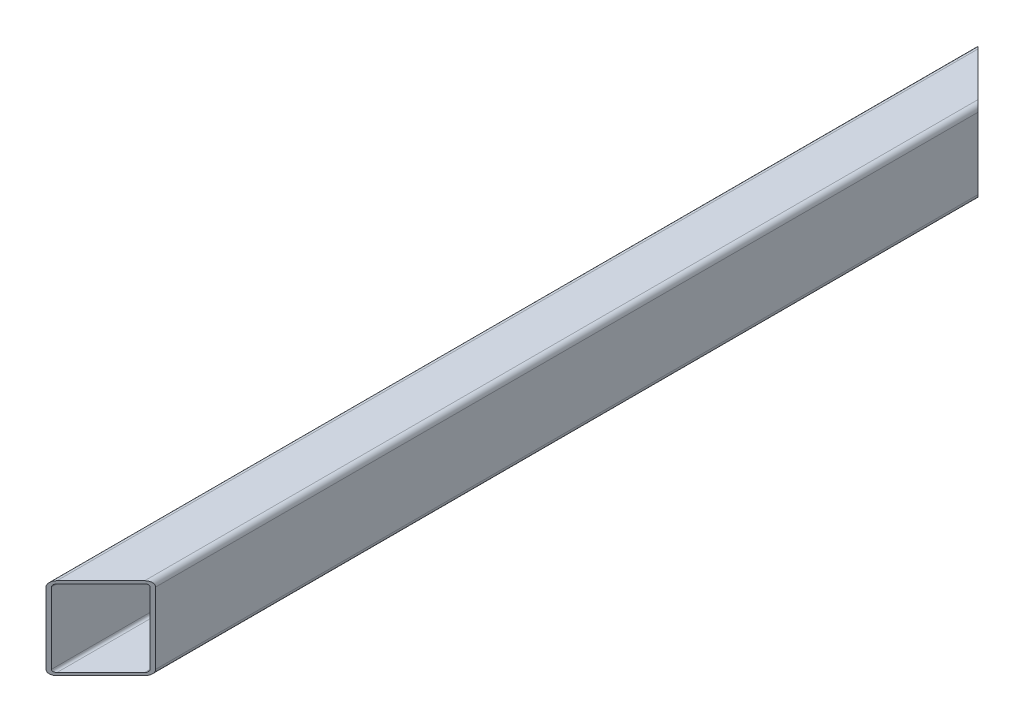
SolidWorks part; units mm, degrees
ref_plane "Plan1" through (0, 0, 0) normal (0, 0, 1) x (1, 0, 0)
ref_plane "Plan2" through (0, 0, 0) normal (0, 1, 0) x (1, 0, 0)
ref_plane "Plan3" through (0, 0, 0) normal (1, 0, 0) x (0, 0, -1)
sketch "Esquisse1" plane through (0, 0, 0) normal (0, 0, 1) x (1, 0, 0)
  line L0 (0, 6.8749) -> (0, -6.8749) construction
  line L1 (-16, -30) -> (16, -30)
  line L2 (-20, -26) -> (-20, 26)
  line L3 (-16, 30) -> (16, 30)
  line L4 (20, -26) -> (20, 26)
  line L5 (-4.7478, 0) -> (4.7478, 0) construction
  arc A0 (-16, 30) -> (-20, 26) centre (-16, 26) ccw
  arc A1 (-20, -26) -> (-16, -30) centre (-16, -26) ccw
  arc A2 (20, -26) -> (16, -30) centre (16, -26) cw
  arc A3 (20, 26) -> (16, 30) centre (16, 26) ccw
  dimension "D1" = 4
  dimension "D2" = 40
  dimension "D3" = 60
extrude "Base-Extru.-Mince" add sketch "Esquisse1" along normal mid plane 680 thin
sketch "Esquisse2" plane through (0, 30, 0) normal (0, 1, 0) x (-1, 0, 0)
  line L0 (20, -340) -> (-20, -300)
  line L1 (-16, -340) -> (16, -340) construction
  line L2 (-20, -340) -> (20, -340)
  line L3 (-20, 340) -> (-20, -340) construction
  line L4 (-20, -300) -> (-20, -340)
  line L5 (20, 340) -> (-20, 300)
  line L6 (-16, 340) -> (16, 340) construction
  line L7 (-20, 340) -> (20, 340)
  line L8 (-20, 340) -> (-20, 300)
  line L9 (20, 340) -> (20, -340) construction
  dimension "D1" = 45
  dimension "D2" = 45
  dimension "D3" = 40
extrude "Enlèv. mat.-Extru.1" cut sketch "Esquisse2" against normal blind 60
